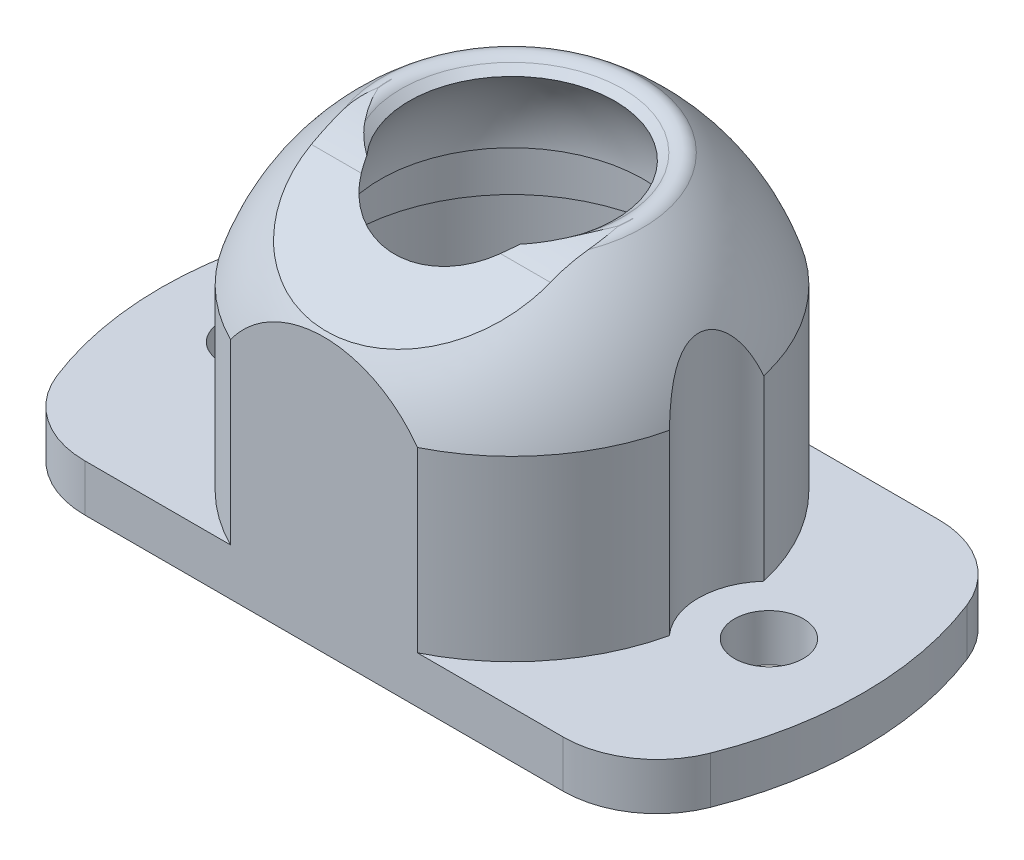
SolidWorks part; units mm, degrees
ref_plane "Plan de face" through (0, 0, 0) normal (0, 0, 1) x (1, 0, 0)
ref_plane "Plan de dessus" through (0, 0, 0) normal (0, 1, 0) x (1, 0, 0)
ref_plane "Plan de droite" through (0, 0, 0) normal (1, 0, 0) x (0, 0, -1)
sketch "Esquisse1" plane through (0, 0, 0) normal (0, 0, 1) x (1, 0, 0)
  line L0 (0, 0) -> (0, 8.4) construction
  line L1 (4.2, 4.2) -> (5.2, 4.2)
  line L3 (5.2, 2.2) -> (5.7, 2.2)
  line L4 (5.7, 2.2) -> (5.7, -3.8)
  line L5 (5.7, -3.8) -> (11.2038, -3.8)
  line L6 (5.2, 4.2) -> (5.2, 2.2)
  line L7 (6.7, -2.3) -> (6.7, 3.3763)
  line L8 (11.2038, -3.8) -> (11.2038, -2.3)
  line L9 (11.2038, -2.3) -> (6.7, -2.3)
  line L10 (3.282, 6.8208) -> (3.5408, 7.0275)
  circle A0 centre (0, 4.2) radius 4.2 construction
  arc A1 (4.1607, 7.0307) -> (6.7, 3.3763) centre (-0.4756, 1.0997) cw
  arc A2 (3.282, 6.8208) -> (4.2, 4.2) centre (0, 4.2) cw
  arc A3 (4.1607, 7.0307) -> (3.5408, 7.0275) centre (3.8528, 6.6367) ccw
  dimension "D1" = 2
  dimension "D4" = 0.5
  dimension "D2" = 0.5
  dimension "D3" = 1
  dimension "D6" = 6
  dimension "D7" = 1.5
  dimension "D8" = 1
revolve "Révolution1" add sketch "Esquisse1" angle 360 about L0
sketch "Esquisse2" plane through (0, -2.3, 0) normal (0, 1, 0) x (-1, 0, 0)
  line L0 (0, 0) -> (-14.5835, 0) construction
  line L1 (13.4464, -12.7104) -> (-12.4095, -12.7104)
  line L2 (13.4464, -12.7104) -> (13.4464, -6)
  line L3 (-12.4095, -6) -> (13.4464, -6)
  line L4 (-12.4095, -12.7104) -> (-12.4095, -6)
  line L5 (-12.4095, 12.7104) -> (-12.4095, 6)
  line L6 (-12.4095, 6) -> (13.4464, 6)
  line L7 (13.4464, 12.7104) -> (13.4464, 6)
  line L8 (13.4464, 12.7104) -> (-12.4095, 12.7104)
  dimension "D1" = 6
extrude "Enlèv. mat.-Extru.1" cut sketch "Esquisse2" against normal blind 10 and the other way blind 10
sketch "Esquisse3" plane through (0, -3.8, 0) normal (0, -1, 0) x (1, 0, 0)
  line L0 (0, 0) -> (11.8153, 0) construction
  line L1 (0, 0) -> (0, 8.0039) construction
  circle A0 centre (8.2, 0) radius 1.1
  circle A1 centre (-8.2, 0) radius 1.1
  dimension "D2" = 2.2
  dimension "D1" = 8.2
extrude "Enlèv. mat.-Extru.2" cut sketch "Esquisse3" against normal through all
fillet "Congé1" radius 3 4 edges at (9.4618, -3.05, -6) (-9.4618, -3.05, -6) (-9.4618, -3.05, 6) (9.4618, -3.05, 6)
sketch "Esquisse4" plane through (0, 0, 0) normal (1, 0, 0) x (0, 0, -1)
  line L0 (0, 0) -> (0, 9.631) construction
  line L1 (-2.5894, 6.65) -> (-9.1559, 3.5195)
  line L2 (-9.1559, 3.5195) -> (-9.1559, 10.5583)
  line L3 (-9.1559, 10.5583) -> (0.3024, 10.5583)
  line L4 (0.3024, 10.5583) -> (0, 7.8845)
  line L5 (-0.4377, 7.1367) -> (0, 7.1367)
  line L6 (0, 7.1367) -> (0, 7.8845)
  arc A0 (-0.4377, 7.1367) -> (-2.5894, 6.65) centre (-0.4377, 2.1367) ccw
  dimension "D1" = 5
extrude "Enlèv. mat.-Extru.3" cut sketch "Esquisse4" against normal through all and the other way through all
sketch "Esquisse5" plane through (0, -2.3, 0) normal (0, 1, 0) x (-1, 0, 0)
  line L0 (0, 0) -> (0, 12.5376) construction
  circle A0 centre (-8.2, 0) radius 2.25
  circle A1 centre (8.2, 0) radius 2.25
  dimension "D1" = 4.5
  dimension "D2" = 4.5
extrude "Enlèv. mat.-Extru.6" cut sketch "Esquisse5" along normal blind 10
